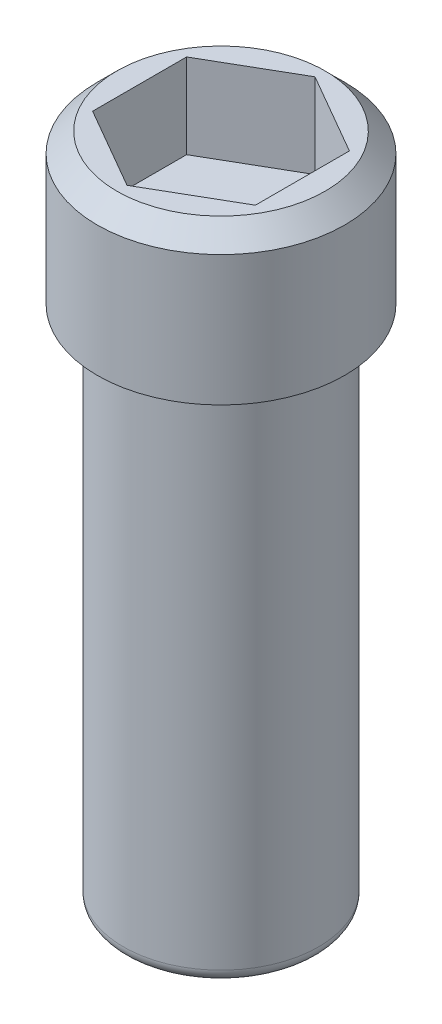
SolidWorks part; units mm, degrees
ref_plane "Face" through (0, 0, 0) normal (0, 0, 1) x (1, 0, 0)
ref_plane "Dessus" through (0, 0, 0) normal (0, 1, 0) x (1, 0, 0)
ref_plane "Droite" through (0, 0, 0) normal (1, 0, 0) x (0, 0, -1)
sketch "Esquisse1" plane through (0, 0, 0) normal (0, 0, 1) x (1, 0, 0)
  line L0 (0, 0) -> (0, 24.462) construction
  line L1 (0, 0) -> (1.5, 0)
  line L2 (1.5, 0) -> (1.5, 8)
  line L3 (1.5, 8) -> (1.9, 8)
  line L4 (1.9, 8) -> (1.9, 10.3)
  line L5 (1.9, 10.3) -> (0, 10.3)
  line L6 (0, 0) -> (0, 10.3)
  dimension "D1" = 3
  dimension "D2" = 3.8
  dimension "D3" = 8
  dimension "D4" = 2.3
revolve "Révolution1" add sketch "Esquisse1" angle 360 about L0
fillet "Congé1" radius 0.2 1 edges at (0, 0, -1.5)
sketch "Esquisse2" plane through (0, 10.3, 0) normal (0, 1, 0) x (-1, 0, 0)
  line L1 (1.25, -0.7217) -> (1.25, 0.7217)
  line L2 (1.25, 0.7217) -> (0, 1.4434)
  line L3 (0, 1.4434) -> (-1.25, 0.7217)
  line L4 (-1.25, 0.7217) -> (-1.25, -0.7217)
  line L5 (-1.25, -0.7217) -> (0, -1.4434)
  line L6 (0, -1.4434) -> (1.25, -0.7217)
  circle A0 centre (0, 0) radius 1.25 construction
  dimension "D1" = 2.5
extrude "Enlèv. mat.-Extru.1" cut sketch "Esquisse2" against normal blind 1.3
chamfer "Chanfrein1" distance 0.3 angle 45 1 edges at (0, 10.3, -1.9)
